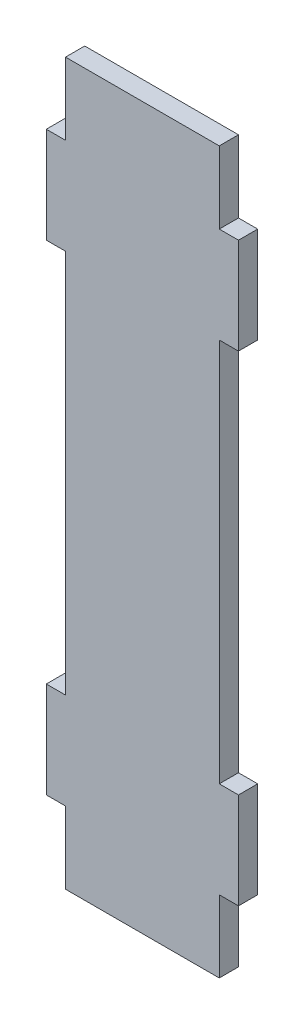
SolidWorks part; units mm, degrees
ref_plane "Front Plane" through (0, 0, 0) normal (0, 0, 1) x (1, 0, 0)
ref_plane "Top Plane" through (0, 0, 0) normal (0, 1, 0) x (1, 0, 0)
ref_plane "Right Plane" through (0, 0, 0) normal (1, 0, 0) x (0, 0, -1)
sketch "Sketch1" plane through (0, 0, 0) normal (0, 0, 1) x (1, 0, 0)
  line L0 (16, 135) -> (20, 135)
  line L1 (-16, 150) -> (16, 150)
  line L2 (-16, 150) -> (-16, 135)
  line L3 (-16, 0) -> (16, 0)
  line L4 (16, 150) -> (16, 135)
  line L5 (-20, 135) -> (-16, 135)
  line L6 (-20, 135) -> (-20, 115)
  line L7 (-20, 115) -> (-16, 115)
  line L8 (20, 135) -> (20, 115)
  line L9 (-20, 35) -> (-16, 35)
  line L10 (-20, 35) -> (-20, 15)
  line L11 (-20, 15) -> (-16, 15)
  line L12 (20, 35) -> (20, 15)
  line L13 (16, 115) -> (16, 35)
  line L14 (16, 115) -> (20, 115)
  line L15 (-16, 115) -> (-16, 35)
  line L16 (-16, 15) -> (-16, 0)
  line L17 (16, 35) -> (20, 35)
  line L18 (16, 15) -> (20, 15)
  line L19 (16, 15) -> (16, 0)
  dimension "D1" = 4
  dimension "D2" = 20
  dimension "D3" = 15
  dimension "D4" = 32
  dimension "D5" = 150
  dimension "D6" = 40
extrude "Boss-Extrude2" add sketch "Sketch1" along normal blind 4
